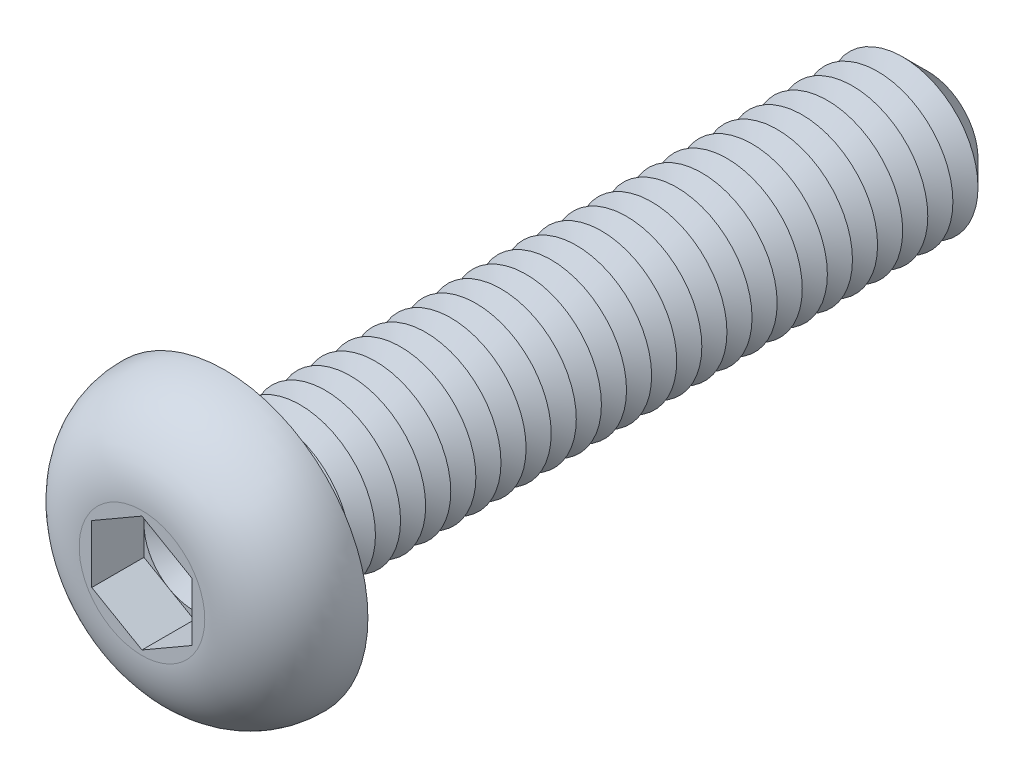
SolidWorks part; units mm, degrees
ref_plane "Front Plane" through (0, 0, 0) normal (0, 0, 1) x (1, 0, 0)
ref_plane "Top Plane" through (0, 0, 0) normal (0, 1, 0) x (1, 0, 0)
ref_plane "Right Plane" through (0, 0, 0) normal (1, 0, 0) x (0, 0, -1)
sketch "Sketch1" plane through (0, 0, 0) normal (1, 0, 0) x (0, 0, -1)
  line L0 (-47.9342, 0) -> (60.3146, 0) construction
sketch "Sketch2" plane through (0, 0, 0) normal (1, 0, 0) x (0, 0, -1)
  line L0 (0, 0) -> (-1.65, 0)
  line L1 (-47.9342, 0) -> (60.3146, 0) construction
  line L2 (-1.65, 0) -> (-1.65, 1.2508)
  line L3 (0, 2.85) -> (0, 0)
  arc A0 (-1.65, 1.2508) -> (0, 2.85) centre (-0.05, 1.2508) cw
  dimension "D1" = 1.6
  dimension "D2" = 1.65
  dimension "D3" = 2.85
revolve "Revolve1" add sketch "Sketch2" angle 360 about L0
sketch "Sketch3" plane through (0, 0, 1.65) normal (0, 0, 1) x (1, 0, 0)
  line L1 (0, 1.1547) -> (-1, 0.5774)
  line L2 (-1, 0.5774) -> (-1, -0.5774)
  line L3 (-1, -0.5774) -> (0, -1.1547)
  line L4 (0, -1.1547) -> (1, -0.5774)
  line L5 (1, -0.5774) -> (1, 0.5774)
  line L6 (1, 0.5774) -> (0, 1.1547)
  circle A0 centre (0, 0) radius 1 construction
  dimension "D1" = 2
extrude "Cut-Extrude1" cut sketch "Sketch3" against normal blind 1.04
sketch "Sketch4" plane through (0, 0, 0) normal (0, 0, -1) x (-1, 0, 0)
  circle A0 centre (0, 0) radius 1.5
  dimension "D1" = 3
extrude "Boss-Extrude1" add sketch "Sketch4" along normal blind 14
chamfer "Chamfer1" distance 0.5 angle 45 1 edges at (-1.5, 0, -14)
sketch "Sketch5" plane through (0, 0, 0) normal (1, 0, 0) x (0, 0, -1)
  line L0 (0.5, 1.5) -> (1, 1.5)
  line L1 (13.5, 1.5) -> (0, 1.5) construction
  line L2 (1, 1.5) -> (0.75, 1.067)
  line L3 (0.75, 1.067) -> (0.5, 1.5)
  line L4 (0, -2.85) -> (0, 2.85) construction
  line L5 (13.5, 1.5) -> (0, 1.5) construction
  dimension "D1" = 0.5
  dimension "D2" = 0.5
revolve "Cut-Revolve1" cut sketch "Sketch5" angle 360 about L0
pattern_linear "LPattern1" count 26 spacing 0.5 along (0, 0, -1) of "Cut-Revolve1"
fillet "Fillet2" radius 0.2 1 edges at (1.5, 0, 0)
sketch "Sketch6" plane through (0, 0, 0.61) normal (0, 0, 1) x (1, 0, 0)
  line L0 (0, -1.1547) -> (1, -0.5774) construction
  circle A0 centre (0, 0) radius 1
extrude "Cut-Extrude2" cut sketch "Sketch6" against normal through all draft 60
